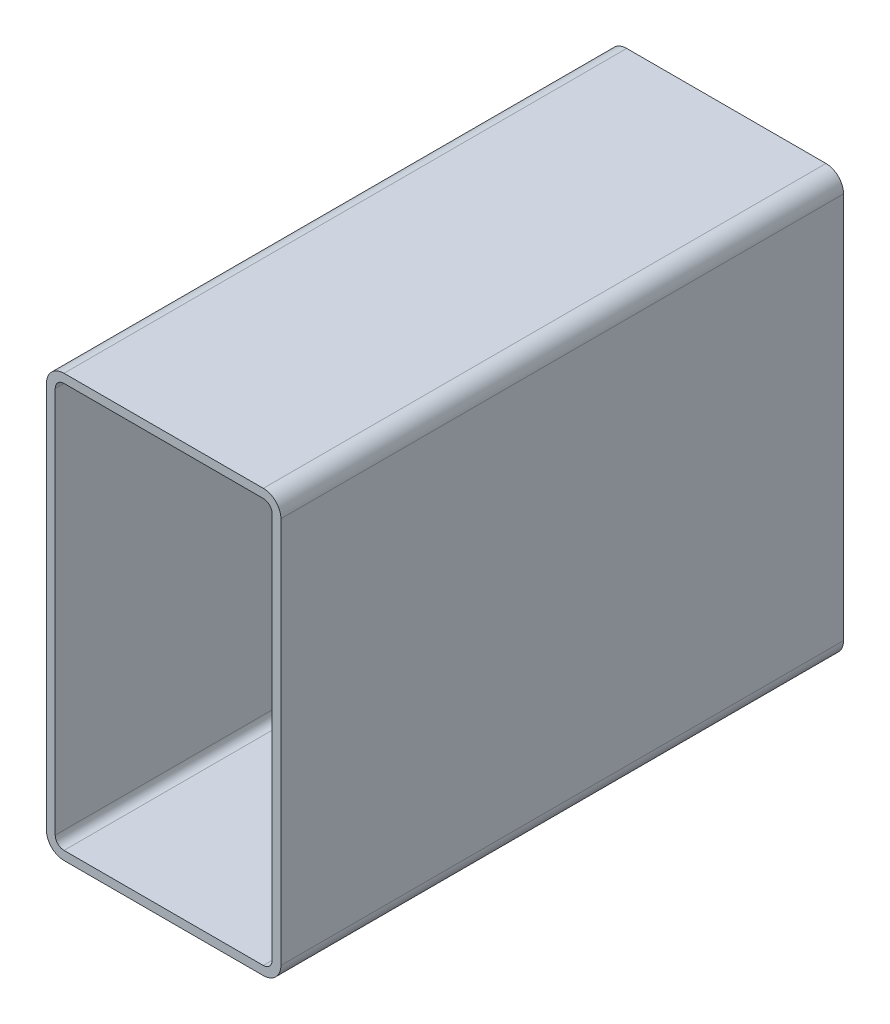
SolidWorks part; units mm, degrees
ref_plane "Front Plane" through (0, 0, 0) normal (0, 0, 1) x (1, 0, 0)
ref_plane "Top Plane" through (0, 0, 0) normal (0, 1, 0) x (1, 0, 0)
ref_plane "Right Plane" through (0, 0, 0) normal (1, 0, 0) x (0, 0, -1)
sketch "Sketch1" plane through (0, 0, 0) normal (0, 0, 1) x (1, 0, 0)
sketch_block_instance "HSS9x5x0.1875-1"
sketch_block "HSS9x5x0.1875"
extrude "Boss-Extrude1" add sketch "Sketch1" along normal blind 304.8
